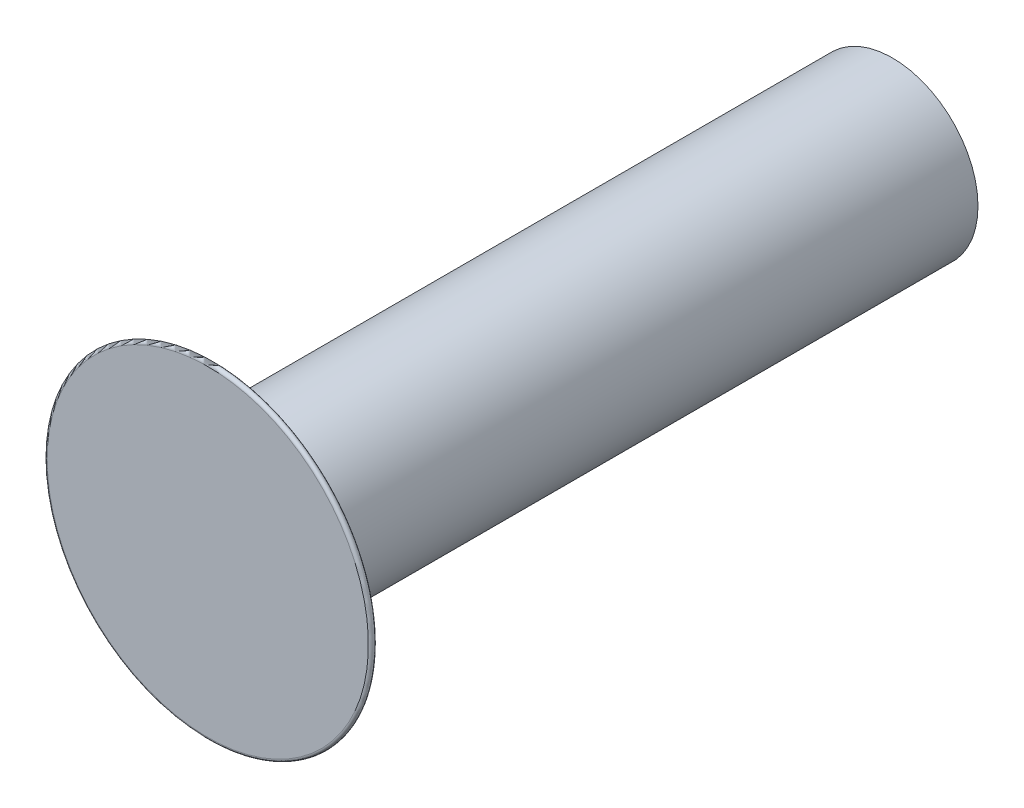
SolidWorks part; units mm, degrees
ref_plane "Front Plane" through (0, 0, 0) normal (0, 0, 1) x (1, 0, 0)
ref_plane "Top Plane" through (0, 0, 0) normal (0, 1, 0) x (1, 0, 0)
ref_plane "Right Plane" through (0, 0, 0) normal (1, 0, 0) x (0, 0, -1)
sketch "BaseBodySke" plane through (0, 0, 0) normal (0, 1, 0) x (1, 0, 0)
  line L0 (0, 0) -> (-6.35, 0)
  line L1 (0, 0) -> (0, 32.7778) construction
  line L2 (0, 0) -> (0, 25.4)
  line L3 (0, 25.4) -> (-3.175, 25.4)
  line L4 (-3.175, 1.8542) -> (-3.175, 25.4)
  line L5 (-6.35, 25.4) -> (-6.35, 0) construction
  line L6 (-6.35, -1.8542) -> (-6.35, 0) construction
  line L7 (-6.35, 0) -> (-3.175, 1.8542)
  line L9 (-3.175, 1.8542) -> (-3.175, 0) construction
  dimension "Diameter" = 6.35
  dimension "Head_Diameter" = 12.7
  dimension "Length" = 25.4
  dimension "Head_Depth" = 1.8542
revolve "BaseBody" add sketch "BaseBodySke" angle 360 about L1
fillet "Fillet" radius 0.1058 1 edges at (6.35, 0, 0)
equation "\"D1@Fillet\" = \"Diameter@BaseBodySke\"/60"
